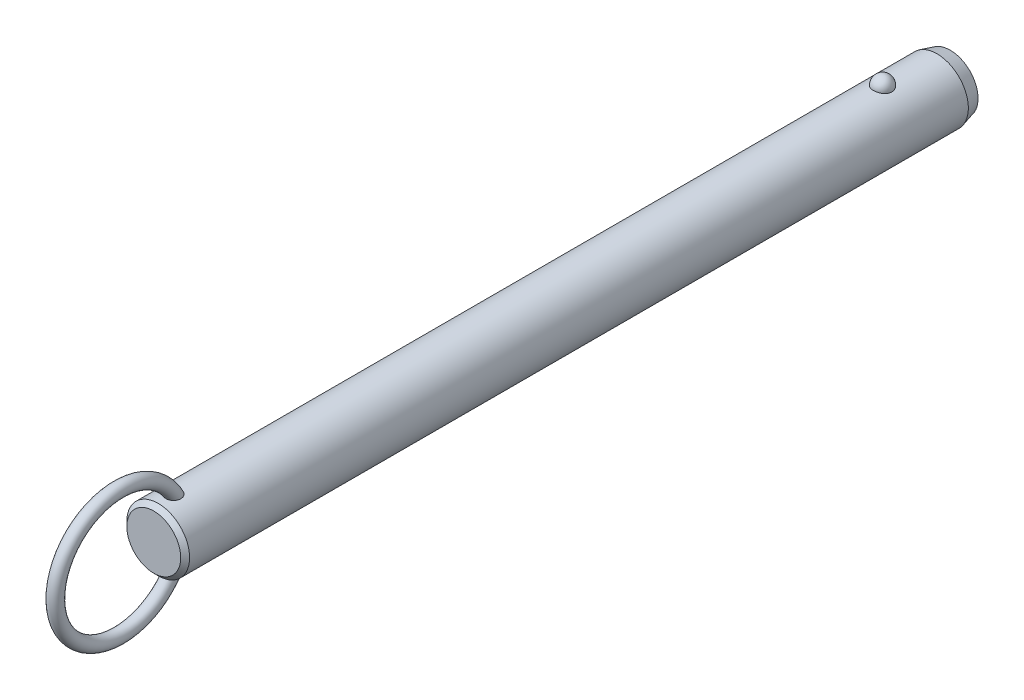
SolidWorks part; units mm, degrees
ref_plane "Front Plane" through (0, 0, 0) normal (0, 0, 1) x (1, 0, 0)
ref_plane "Top Plane" through (0, 0, 0) normal (0, 1, 0) x (1, 0, 0)
ref_plane "Right Plane" through (0, 0, 0) normal (1, 0, 0) x (0, 0, -1)
sketch "Sketch2" plane through (0, 0, 0) normal (0, 0, 1) x (1, 0, 0)
  circle A0 centre (0, 0) radius 7.1
  point P3 (0, 7.1)
  dimension "D1" = 14.2
extrude "Boss-Extrude1" add sketch "Sketch2" along normal blind 154.9
sketch "Sketch3" plane through (0, 0, 0) normal (0, 0, -1) x (-1, 0, 0)
  circle A0 centre (0, 0) radius 7.1
  dimension "D1" = 14.2
extrude "Boss-Extrude2" add sketch "Sketch3" along normal blind 17.4
chamfer "Chamfer1" distance 3 angle 15 1 edges at (-7.1, 0, -17.4)
sketch "Sketch12" plane through (0, 0, 0) normal (1, 0, 0) x (0, 0, -1)
  line L0 (-154.9, 7.1) -> (-154.9, -7.1) construction
  point P0 (-154.9, 0)
sketch "Sketch13" plane through (0, 0, 0) normal (1, 0, 0) x (0, 0, -1)
  circle A0 centre (-170.75, 0) radius 15.85
  point P2 (-154.9, 0)
  dimension "D1" = 31.7
sketch "Sketch14" plane through (0, 0, 0) normal (0, 1, 0) x (1, 0, 0)
  circle A0 centre (0, -156.4) radius 1.5
  point P2 (0, -154.9)
  dimension "D1" = 3
sweep "Sweep1" add profiles "Sketch14" path "Sketch13"
sketch "Sketch15" plane through (0, 0, 154.9) normal (0, 0, 1) x (1, 0, 0)
  circle A0 centre (0, 0) radius 7.1
  dimension "D1" = 14.2
extrude "Boss-Extrude3" add sketch "Sketch15" along normal blind 7.92
chamfer "Chamfer2" distance 1 angle 45 1 edges at (7.1, 0, 162.82)
sketch "Sketch18" plane through (0, 0, 0) normal (1, 0, 0) x (0, 0, -1)
  line L0 (14.4, 7.1) -> (-156.5792, 7.1) construction
  line L1 (2.1, 9.2) -> (2.1, 5)
  line L2 (-156.5792, -7.1) -> (14.4, -7.1) construction
  arc A0 (2.1, 9.2) -> (2.1, 5) centre (2.1, 7.1) ccw
  point P4 (0, 7.1)
  dimension "D1" = 16.3
revolve "Revolve1" add sketch "Sketch18" angle 360 about L1
